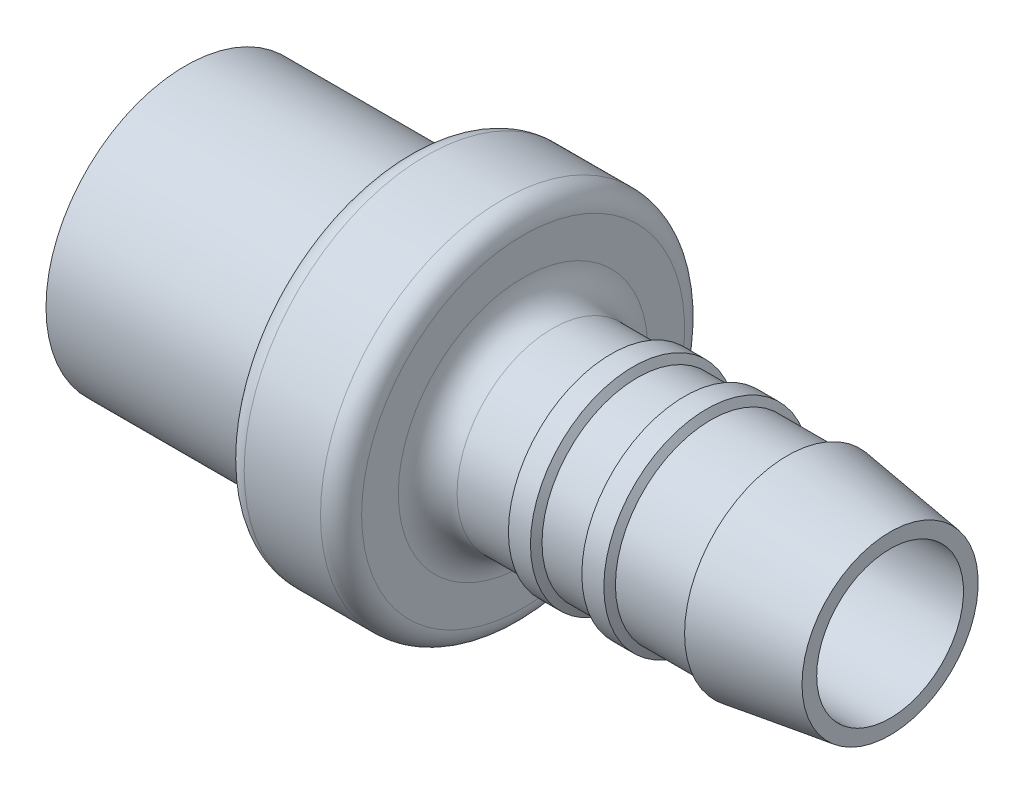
SolidWorks part; units mm, degrees
ref_plane "Front Plane" through (0, 0, 0) normal (0, 0, 1) x (1, 0, 0)
ref_plane "Top Plane" through (0, 0, 0) normal (0, 1, 0) x (1, 0, 0)
ref_plane "Right Plane" through (0, 0, 0) normal (1, 0, 0) x (0, 0, -1)
sketch "Esquisse1" plane through (0, 0, 0) normal (0, 0, 1) x (1, 0, 0)
  line L0 (0, 9.5) -> (-15, 9.5)
  line L1 (-15, 9.5) -> (-15, 6.5)
  line L2 (19, 6.5) -> (19, 7)
  line L3 (33, 5) -> (33, 6)
  line L4 (33, 6) -> (26, 7)
  line L5 (26, 7) -> (26, 6.5)
  line L6 (26, 6.5) -> (20.7887, 6.5)
  line L7 (8, 6.5) -> (8, 11)
  line L8 (6.6, 12.4) -> (1.4, 12.4)
  line L9 (0, 11) -> (0, 9.5)
  line L10 (-21.3985, 0) -> (91.0253, 0) construction
  line L11 (-15, 6.5) -> (0, 6.5)
  line L12 (0, 6.5) -> (1.2423, 5)
  line L13 (1.2423, 5) -> (33, 5)
  line L14 (19, 7) -> (20.5, 7)
  line L15 (20.5, 7) -> (20.7887, 6.5)
  line L16 (14, 6.5) -> (14, 7)
  line L17 (14, 7) -> (15.5, 7)
  line L18 (15.5, 7) -> (15.7887, 6.5)
  line L19 (14, 6.5) -> (8, 6.5)
  line L20 (19, 6.5) -> (15.7887, 6.5)
  arc A0 (0, 11) -> (1.4, 12.4) centre (1.4, 11) cw
  arc A1 (6.6, 12.4) -> (8, 11) centre (6.6, 11) cw
  dimension "D11" = 0.5
  dimension "D17" = 8
  dimension "D1" = 6
  dimension "D2" = 9.5
  dimension "D3" = 7
  dimension "D4" = 6.5
  dimension "D5" = 7
  dimension "D6" = 6.5
  dimension "D7" = 7
  dimension "D8" = 1.5
  dimension "D9" = 15
  dimension "D10" = 5
  dimension "D12" = 1.5
  dimension "D13" = 60
  dimension "D14" = 2
  dimension "D15" = 18
  dimension "D16" = 12.4
revolve "Révolution1" add sketch "Esquisse1" angle 360 about L10
fillet "Congé1" radius 2 1 edges at (8, 0, 6.5)
